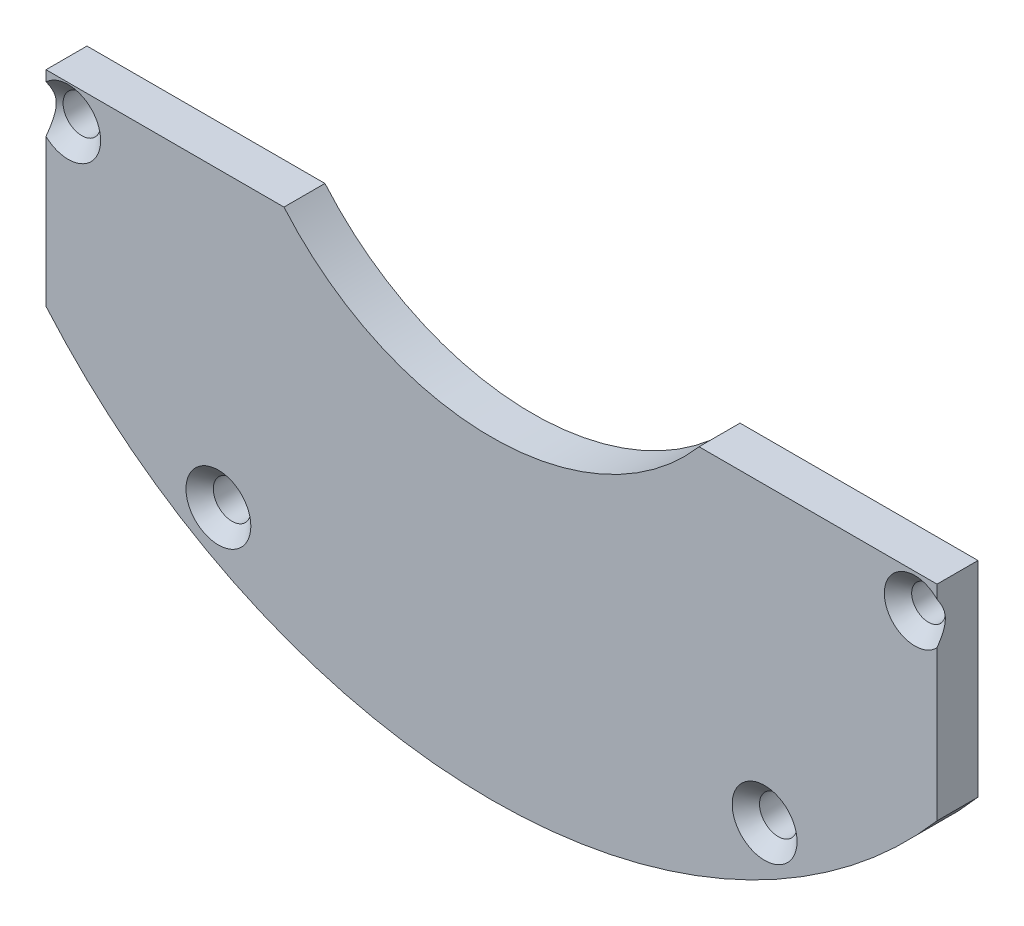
SolidWorks part; units mm, degrees
ref_plane "Plan de face" through (0, 0, 0) normal (0, 0, 1) x (1, 0, 0)
ref_plane "Plan de dessus" through (0, 0, 0) normal (0, 1, 0) x (1, 0, 0)
ref_plane "Plan de droite" through (0, 0, 0) normal (1, 0, 0) x (0, 0, -1)
sketch "Esquisse3" plane through (0, 0, 0) normal (0, 0, 1) x (1, 0, 0)
  line L0 (-65.25, -26) -> (-65.25, -56.0218)
  line L1 (65.25, -26) -> (65.25, -56.0218)
  line L4 (30.3974, -26) -> (65.25, -26)
  line L6 (-65.25, -26) -> (-30.3974, -26)
  arc A0 (-65.25, -56.0218) -> (65.25, -56.0218) centre (0, 0) ccw
  arc A1 (-30.3974, -26) -> (30.3974, -26) centre (0, 0) ccw
  dimension "D1" = 172
  dimension "D2" = 26
  dimension "D3" = 80
extrude "Boss.-Extru.2" add sketch "Esquisse3" along normal blind 6
sketch "Esquisse5" plane through (0, 0, 6) normal (0, 0, 1) x (1, 0, 0)
  line L0 (-68.5542, -31) -> (72.2325, -31) construction
  circle A0 centre (-40, -68.9093) radius 2.75
  circle A1 centre (40, -68.9093) radius 2.75
  circle A2 centre (-62, -31) radius 2.75
  circle A3 centre (62, -31) radius 2.4679
  dimension "D1" = 5.5
  dimension "D2" = 40
  dimension "D3" = 40
  dimension "D4" = 62
  dimension "D5" = 62
extrude "Enlèv. mat.-Extru.2" cut sketch "Esquisse5" against normal blind 10
chamfer "Chanfrein1" distance 2 angle 45 4 edges at (64.4679, -31, 6) (42.75, -68.9093, 6) (-37.25, -68.9093, 6) (-59.25, -31, 6)
